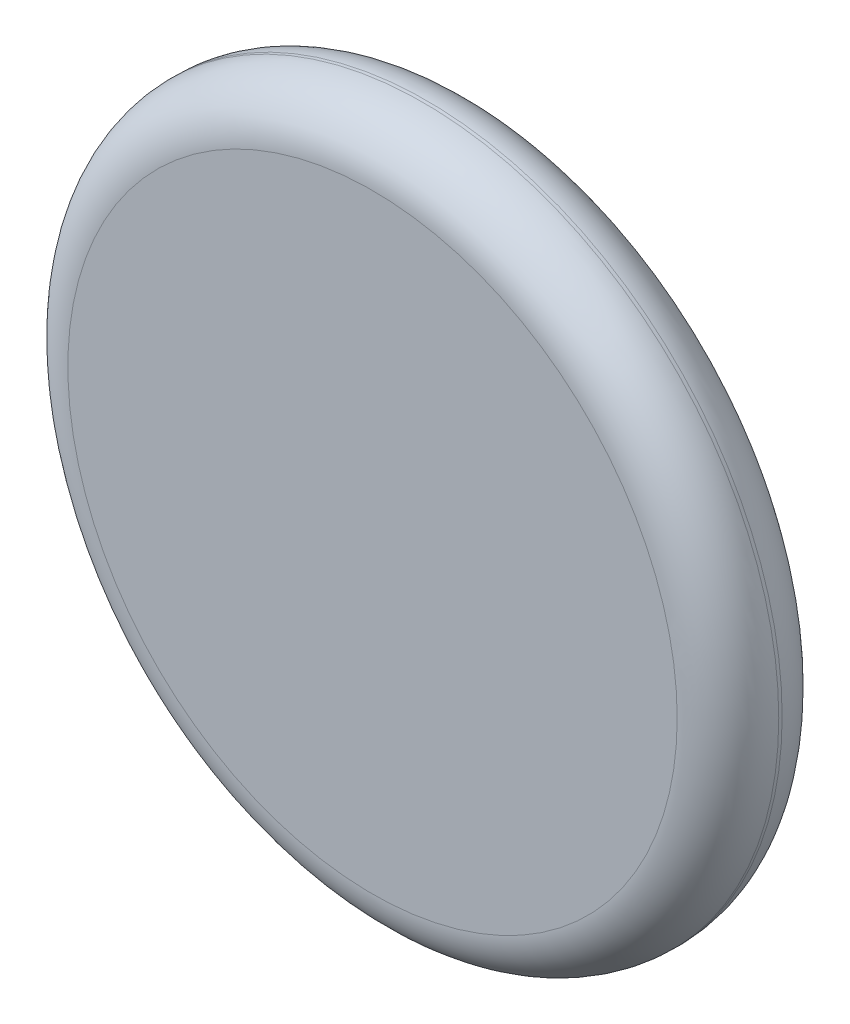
SolidWorks part; units mm, degrees
ref_plane "Front Plane" through (0, 0, 0) normal (0, 0, 1) x (1, 0, 0)
ref_plane "Top Plane" through (0, 0, 0) normal (0, 1, 0) x (1, 0, 0)
ref_plane "Right Plane" through (0, 0, 0) normal (1, 0, 0) x (0, 0, -1)
sketch "Sketch1" plane through (0, 0, 0) normal (0, 0, 1) x (1, 0, 0)
  circle A0 centre (0, 0) radius 21
  dimension "D1" = 42
extrude "Boss-Extrude1" add sketch "Sketch1" along normal blind 6.2
fillet "Fillet1" radius 3 2 edges at (21, 0, 0) (21, 0, 6.2)
sketch "Sketch2" plane through (0, 0, 0) normal (0, 0, -1) x (-1, 0, 0)
  circle A0 centre (0, 0) radius 1
  dimension "D1" = 2
extrude "Cut-Extrude1" cut sketch "Sketch2" against normal blind 2
